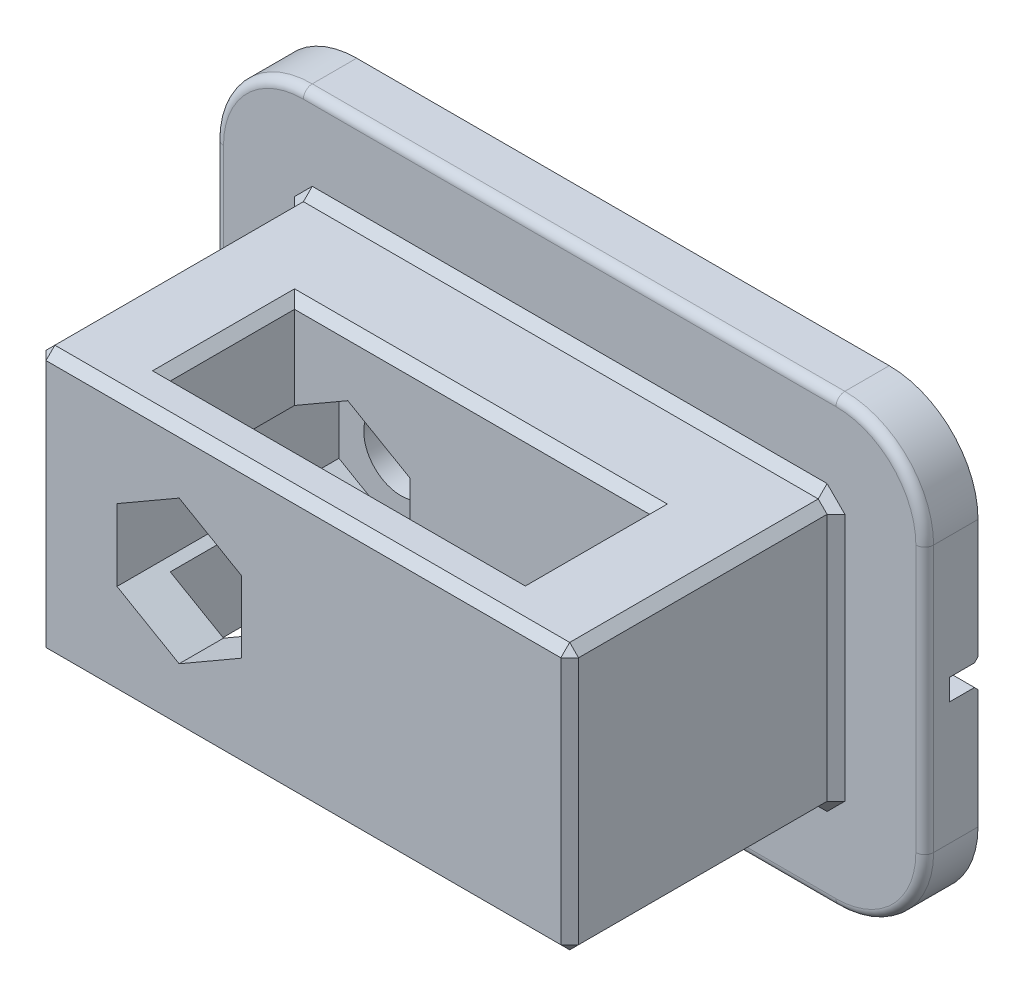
SolidWorks part; units mm, degrees
ref_plane "Plan de face" through (0, 0, 0) normal (0, 0, 1) x (1, 0, 0)
ref_plane "Plan de dessus" through (0, 0, 0) normal (0, 1, 0) x (1, 0, 0)
ref_plane "Plan de droite" through (0, 0, 0) normal (1, 0, 0) x (0, 0, -1)
sketch "Esquisse1" plane through (0, 0, 0) normal (0, 0, 1) x (1, 0, 0)
  line L1 (5, 0) -> (35, 0)
  line L2 (0, 5) -> (0, 20)
  line L3 (5, 25) -> (35, 25)
  line L4 (40, 5) -> (40, 20)
  arc A0 (35, 25) -> (40, 20) centre (35, 20) cw
  arc A1 (40, 5) -> (35, 0) centre (35, 5) cw
  arc A2 (5, 0) -> (0, 5) centre (5, 5) cw
  arc A3 (0, 20) -> (5, 25) centre (5, 20) cw
  point P7 (40, 25)
  point P12 (0, 0)
  point P15 (0, 25)
  dimension "D3" = 5
  dimension "D1" = 40
  dimension "D2" = 25
extrude "Boss.-Extru.1" add sketch "Esquisse1" along normal blind 3
sketch "Esquisse2" plane through (0, 0, 3) normal (0, 0, 1) x (1, 0, 0)
  line L0 (0, 20) -> (0, 5) construction
  line L1 (5, 20) -> (35, 20)
  line L2 (5, 20) -> (5, 5)
  line L3 (5, 5) -> (35, 5)
  line L4 (35, 20) -> (35, 5)
  line L5 (5, 0) -> (35, 0) construction
  dimension "D1" = 30
  dimension "D2" = 5
  dimension "D3" = 15
  dimension "D4" = 5
extrude "Boss.-Extru.2" add sketch "Esquisse2" along normal blind 15
sketch "Esquisse3" plane through (0, 20, 0) normal (0, 1, 0) x (1, 0, 0)
  line L0 (35, -18) -> (35, -3) construction
  line L1 (10, -8.5) -> (30, -8.5)
  line L2 (10, -8.5) -> (10, -15.5)
  line L3 (10, -15.5) -> (30, -15.5)
  line L4 (30, -8.5) -> (30, -15.5)
  line L6 (35, -18) -> (5, -18) construction
  dimension "D1" = 7
  dimension "D2" = 20
  dimension "D3" = 5
  dimension "D4" = 2.5
extrude "Enlèv. mat.-Extru.1" cut sketch "Esquisse3" against normal through all
sketch "Esquisse4" plane through (0, 0, 18) normal (0, 0, 1) x (1, 0, 0)
  line L1 (0, 20) -> (0, 5) construction
  line L2 (13, 16.5415) -> (9.5, 14.5207)
  line L3 (9.5, 14.5207) -> (9.5, 10.4793)
  line L4 (9.5, 10.4793) -> (13, 8.4585)
  line L5 (13, 8.4585) -> (16.5, 10.4793)
  line L6 (16.5, 10.4793) -> (16.5, 14.5207)
  line L8 (16.5, 14.5207) -> (13, 16.5415)
  line L9 (35, 25) -> (5, 25) construction
  circle A0 centre (13, 12.5) radius 3.5 construction
  dimension "D1" = 13
  dimension "D2" = 12.5
  dimension "D3" = 7
extrude "Enlèv. mat.-Extru.3" cut sketch "Esquisse4" against normal blind 12.5
sketch "Esquisse5" plane through (0, 0, 5.5) normal (0, 0, 1) x (1, 0, 0)
  line L2 (0, 20) -> (0, 5) construction
  line L4 (35, 25) -> (5, 25) construction
  circle A0 centre (13, 12.5) radius 2.1
  point P2 (0, 0)
  point P5 (0, 0)
  dimension "D1" = 4.2
  dimension "D2" = 13
  dimension "D3" = 12.5
extrude "Enlèv. mat.-Extru.4" cut sketch "Esquisse5" against normal through all
chamfer "Chanfrein1" distance 0.5 angle 45 20 edges at (20, 5, 8.5) (10, 5, 12) (30, 5, 12) (20, 5, 15.5) (30, 20, 12) (20, 20, 15.5) (10, 20, 12) (20, 20, 8.5) (20, 5, 3) (20, 20, 3) (5, 12.5, 3) (5, 5, 10.5) (5, 20, 10.5) (5, 12.5, 18) (20, 5, 18) (20, 20, 18) (35, 12.5, 3) (35, 5, 10.5) (35, 12.5, 18) (35, 20, 10.5)
fillet "Congé1" radius 0.5 8 edges at (1.4645, 23.5355, 3) (20, 25, 3) (38.5355, 23.5355, 3) (40, 12.5, 3) (38.5355, 1.4645, 3) (20, 0, 3) (1.4645, 1.4645, 3) (0, 12.5, 3)
sketch "Esquisse6" plane through (0, 0, 0) normal (0, 0, -1) x (-1, 0, 0)
  line L0 (-35, 25) -> (-5, 25) construction
  line L1 (-42.4115, 13.1) -> (1.9358, 13.1)
  line L2 (-42.4115, 13.1) -> (-42.4115, 11.9)
  line L3 (-42.4115, 11.9) -> (1.9358, 11.9)
  line L4 (1.9358, 13.1) -> (1.9358, 11.9)
  dimension "D1" = 1.2
  dimension "D2" = 11.9
extrude "Enlèv. mat.-Extru.5" cut sketch "Esquisse6" against normal blind 1.6
chamfer "Chanfrein2" distance 0.2 angle 45 4 edges at (27.5062, 11.9, 0) (5.4938, 11.9, 0) (5.4938, 13.1, 0) (27.5062, 13.1, 0)
